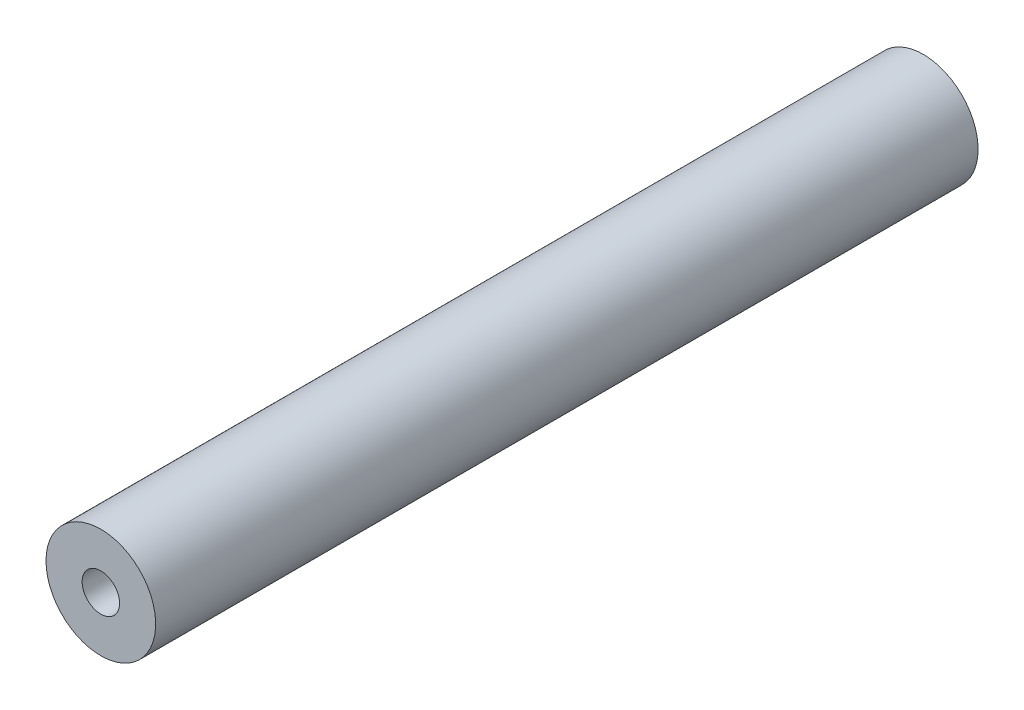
SolidWorks part; units mm, degrees
ref_plane "Plano frontal" through (0, 0, 0) normal (0, 0, 1) x (1, 0, 0)
ref_plane "Plano superior" through (0, 0, 0) normal (0, 1, 0) x (1, 0, 0)
ref_plane "Plano direito" through (0, 0, 0) normal (1, 0, 0) x (0, 0, -1)
sketch "Esboço1" plane through (0, 0, 0) normal (0, 0, 1) x (1, 0, 0)
  circle A0 centre (0, 0) radius 3
  dimension "D1" = 6
extrude "Ressalto-extrusão1" add sketch "Esboço1" along normal blind 45
hole_wizard "Broca de rosquear para tarraxa de M2.51" positions "3DSketch1" profile "Esboço3" hole size "M2.5" standard "ISO"
sketch3d "3DSketch1"
  line L0 (0, 0, 45) -> (0, 0, 0) construction
  point P0 (0, 0, 45)
sketch "Esboço3" plane through (0, 0, 45) normal (1, 0, 0) x (0, -1, 0)
  line L0 (0, 0) -> (0, 8.6159)
  line L1 (0, 8.6159) -> (1.025, 8)
  line L2 (1.025, 8) -> (1.025, 0)
  line L5 (1.025, 0) -> (0, 0)
  line L10 (0, 8.6159) -> (-1.025, 8) construction
  line L11 (0, -6.35) -> (0, 107.95) construction
  dimension "Hole Dia." = 2.05
  dimension "Hole Depth" = 8
  dimension "Drill Angle" = 118
hole_wizard "Broca de rosquear para tarraxa de M2.52" positions "3DSketch10" profile "Esboço15" hole size "M2.5" standard "ISO"
sketch3d "3DSketch10"
  point P0 (0, 0, 0)
  point P3 (0, 0, 0)
  point P5 (0, 0, 0)
  point P7 (0, 0, 0)
  point P9 (0, 0, 0)
sketch "Esboço15" plane through (0, 0, 0) normal (1, 0, 0) x (0, 1, 0)
  line L0 (0, 0) -> (0, 8.6159)
  line L1 (0, 8.6159) -> (1.025, 8)
  line L2 (1.025, 8) -> (1.025, 0)
  line L5 (1.025, 0) -> (0, 0)
  line L10 (0, 8.6159) -> (-1.025, 8) construction
  line L11 (0, -6.35) -> (0, 107.95) construction
  dimension "Hole Dia." = 2.05
  dimension "Hole Depth" = 8
  dimension "Drill Angle" = 118
